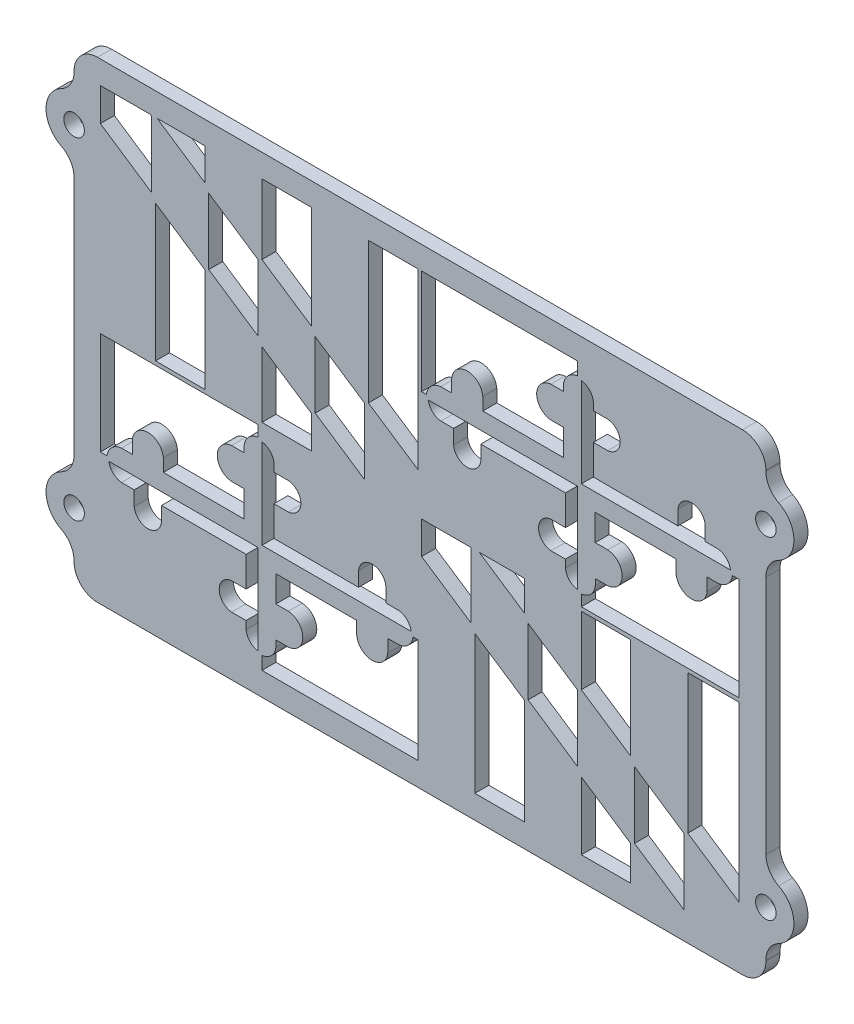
SolidWorks part; units mm, degrees
ref_plane "Front Plane" through (0, 0, 0) normal (0, 0, 1) x (1, 0, 0)
ref_plane "Top Plane" through (0, 0, 0) normal (0, 1, 0) x (1, 0, 0)
ref_plane "Right Plane" through (0, 0, 0) normal (1, 0, 0) x (0, 0, -1)
sketch "Sketch1" plane through (0, 0, 0) normal (0, 0, 1) x (1, 0, 0)
  line L1 (-74, -35.5) -> (74, -35.5) construction
  line L2 (-74, -35.5) -> (-74, 35.5) construction
  line L3 (-74, 35.5) -> (74, 35.5) construction
  line L4 (74, -35.5) -> (74, 35.5) construction
  line L5 (-74, -35.5) -> (74, 35.5) construction
  line L6 (-74, 35.5) -> (74, -35.5) construction
  circle A0 centre (-74, 35.5) radius 2.2
  circle A1 centre (-74, 35.5) radius 6
  circle A2 centre (74, 35.5) radius 2.2
  circle A3 centre (74, 35.5) radius 6
  circle A4 centre (74, -35.5) radius 2.2
  circle A5 centre (74, -35.5) radius 6
  circle A6 centre (-74, -35.5) radius 2.2
  circle A7 centre (-74, -35.5) radius 6
  point P0 (0, 0)
  dimension "D3" = 4.4
  dimension "D4" = 12
  dimension "D5" = 4.4
  dimension "D6" = 12
  dimension "D7" = 4.4
  dimension "D8" = 12
  dimension "D9" = 4.4
  dimension "D10" = 12
  dimension "D1" = 148
  dimension "D2" = 71
extrude "Boss-Extrude1" add sketch "Sketch1" along normal blind 3
sketch "Sketch2" plane through (0, 0, 0) normal (0, 0, 1) x (1, 0, 0)
  line L1 (-74, -50.5) -> (74, -50.5)
  line L2 (-74, -50.5) -> (-74, 50.5)
  line L3 (-74, 50.5) -> (74, 50.5)
  line L4 (74, -50.5) -> (74, 50.5)
  circle A2 centre (74, -35.5) radius 6 construction
  circle A3 centre (74, 35.5) radius 6 construction
  point P0 (0, 0)
  dimension "D2" = 15
  dimension "D3" = 15
  dimension "D1" = 148
  dimension "D4" = 74
extrude "Boss-Extrude3" add sketch "Sketch2" along normal blind 3 contours L3 L4 L1 L2
sketch "Sketch3" plane through (0, 0, 0) normal (0, 0, 1) x (1, 0, 0)
  line L0 (-74, 33.3) -> (-74, 37.7) construction
  line L1 (74, 33.3) -> (74, 37.7) construction
  line L2 (74, -37.7) -> (74, -33.3) construction
  line L3 (-74, -37.7) -> (-74, -33.3) construction
  circle A0 centre (-74, 35.5) radius 2.2
  circle A1 centre (74, 35.5) radius 2.2
  circle A2 centre (74, -35.5) radius 2.2
  circle A3 centre (-74, -35.5) radius 2.2
  dimension "D1" = 4.4
  dimension "D2" = 4.4
  dimension "D3" = 4.4
  dimension "D4" = 4.4
extrude "Cut-Extrude2" cut sketch "Sketch3" along normal blind 3
fillet "Fillet2" radius 5
fillet "Fillet3" radius 5
sketch "Sketch4" plane through (0, 0, 3) normal (0, 0, 1) x (1, 0, 0)
  line L0 (-24.1234, -47.7608) -> (29.7121, -47.7608) construction
  line L2 (-69, -50.5) -> (69, -50.5) construction
  line L3 (-68, -45.5) -> (68, -45.5)
  line L4 (-68, -45.5) -> (-68, 45.5)
  line L5 (-68, 45.5) -> (68, 45.5)
  line L6 (68, -45.5) -> (68, 45.5)
  line L7 (-68, -45.5) -> (68, 45.5) construction
  line L8 (-68, 45.5) -> (68, -45.5) construction
  line L10 (74, -25.702) -> (74, 25.702) construction
  point P4 (0, 0)
  dimension "D1" = 5
  dimension "D2" = 6
sketch "Sketch5" plane through (0, 0, 3) normal (0, 0, 1) x (1, 0, 0)
  line L0 (-68.3847, 45.5773) -> (-68.3847, 38.5233)
  line L1 (-56.2579, 45.5773) -> (-46.0193, 38.7533)
  line L2 (-57.7362, 45.5773) -> (-57.407, 45.3579)
  line L3 (-11.8563, 0.8277) -> (-22.4241, 7.8747)
  line L4 (12.6832, -0.3719) -> (22.3067, -6.786)
  line L5 (11.7389, -45.5013) -> (11.7389, -15.8922)
  line L6 (22.3067, -45.5013) -> (22.3067, -22.9392)
  line L7 (34.5142, -45.5013) -> (34.5142, -31.0798)
  line L8 (45.082, -45.5013) -> (45.082, -38.1268)
  line L9 (56.4697, -44.7351) -> (56.4697, -30.5409)
  line L10 (-11.0364, 45.5773) -> (-11.0364, 15.4372)
  line L11 (-23.244, 45.5773) -> (-23.244, 23.5736)
  line L12 (-33.8118, 45.5773) -> (-33.8118, 30.617)
  line L13 (-46.0193, 45.5773) -> (-46.0193, 38.7533)
  line L14 (-57.407, 45.3579) -> (-57.407, 31.2029)
  line L15 (37.5054, 5.8845) -> (37.5054, 7.1719)
  line L16 (37.5054, 7.1719) -> (40.1998, 7.1719)
  line L17 (40.1814, 13.8239) -> (37.4881, 13.8239)
  line L18 (37.4881, 13.8239) -> (37.4881, 19.4384)
  line L19 (37.4881, 19.4384) -> (54.7798, 19.4384)
  line L20 (54.7798, 19.4384) -> (54.7798, 16.7451)
  line L21 (61.4318, 16.7267) -> (61.4318, 19.4211)
  line L22 (61.4318, 19.4211) -> (63.767, 19.4211)
  line L23 (30.7032, 39.7308) -> (30.7032, 38.4435)
  line L24 (30.7032, 38.4435) -> (28.0088, 38.4435)
  line L25 (28.0272, 31.7914) -> (30.7204, 31.7914)
  line L26 (30.7204, 31.7914) -> (30.7204, 26.1769)
  line L27 (30.7204, 26.1769) -> (13.4287, 26.1769)
  line L28 (13.4287, 26.1769) -> (13.4287, 28.8702)
  line L29 (6.7767, 28.8886) -> (6.7767, 26.1942)
  line L30 (6.7767, 26.1942) -> (4.4416, 26.1942)
  line L31 (-37.6228, -5.8085) -> (-37.6228, -7.0958)
  line L32 (-37.6228, -7.0958) -> (-40.3172, -7.0958)
  line L33 (-40.2988, -13.7478) -> (-37.6056, -13.7478)
  line L34 (-37.6056, -13.7478) -> (-37.6056, -19.3623)
  line L35 (-37.6056, -19.3623) -> (-54.8973, -19.3623)
  line L36 (-54.8973, -19.3623) -> (-54.8973, -16.6691)
  line L37 (-61.5493, -16.6507) -> (-61.5493, -19.3451)
  line L38 (-61.5493, -19.3451) -> (-63.8844, -19.3451)
  line L39 (-30.8206, -39.6548) -> (-30.8206, -38.3674)
  line L40 (-30.8206, -38.3674) -> (-28.1262, -38.3674)
  line L41 (-28.1446, -31.7154) -> (-30.8379, -31.7154)
  line L42 (-30.8379, -31.7154) -> (-30.8379, -26.1009)
  line L43 (-30.8379, -26.1009) -> (-13.5462, -26.1009)
  line L44 (-13.5462, -26.1009) -> (-13.5462, -28.7942)
  line L45 (-6.8942, -28.8126) -> (-6.8942, -26.1182)
  line L46 (-6.8942, -26.1182) -> (-4.559, -26.1182)
  line L47 (-0.4687, 45.5773) -> (-0.4687, 8.3938)
  line L48 (-68.3847, -0.3719) -> (-34.6317, -0.3719)
  line L49 (0.3512, -0.3719) -> (0.3512, -7.3129)
  line L50 (0.3512, -0.3719) -> (10.919, -0.3719)
  line L51 (-34.6317, -0.3719) -> (-34.6317, -2.7353)
  line L52 (-0.4687, -23.1416) -> (-1.4875, -23.1416)
  line L53 (33.6943, 45.5773) -> (33.6943, 42.804)
  line L54 (68.2673, 22.3977) -> (66.8385, 22.3977)
  line L55 (33.6943, 22.3977) -> (1.7834, 22.3977)
  line L56 (33.6943, 22.3977) -> (33.6943, 3.2244)
  line L57 (63.7482, 25.7842) -> (61.0219, 25.7842)
  line L58 (61.0219, 25.7842) -> (61.0219, 28.8702)
  line L59 (55.1898, 28.853) -> (55.1898, 25.767)
  line L60 (55.1898, 25.767) -> (37.0782, 25.767)
  line L61 (37.0782, 25.767) -> (37.0782, 32.2014)
  line L62 (37.0782, 32.2014) -> (40.1642, 32.2014)
  line L63 (40.1814, 38.0335) -> (37.0954, 38.0335)
  line L64 (37.0954, 38.0335) -> (37.0954, 39.712)
  line L65 (34.5142, 0.448) -> (68.2673, 0.448)
  line L66 (4.4604, 19.8311) -> (7.1867, 19.8311)
  line L67 (7.1867, 19.8311) -> (7.1867, 16.7451)
  line L68 (13.0188, 16.7623) -> (13.0188, 19.8483)
  line L69 (13.0188, 19.8483) -> (31.1304, 19.8483)
  line L70 (31.1304, 19.8483) -> (31.1304, 13.4139)
  line L71 (31.1304, 13.4139) -> (28.0444, 13.4139)
  line L72 (28.0271, 7.5818) -> (31.1131, 7.5818)
  line L73 (31.1131, 7.5818) -> (31.1131, 5.9033)
  line L74 (1.3701, 23.2176) -> (0.3512, 23.2176)
  line L75 (34.5142, 2.8113) -> (34.5142, 0.448)
  line L76 (34.5142, 42.3909) -> (34.5142, 23.2176)
  line L77 (66.4251, 23.2176) -> (34.5142, 23.2176)
  line L78 (-33.8118, 0.448) -> (-23.244, 0.448)
  line L79 (-33.8118, -3.1484) -> (-33.8118, -22.3217)
  line L80 (-34.6317, -23.1416) -> (-34.6317, -42.3149)
  line L81 (-34.6317, -23.1416) -> (-66.5426, -23.1416)
  line L82 (-4.5778, -19.7551) -> (-7.3041, -19.7551)
  line L83 (-7.3041, -19.7551) -> (-7.3041, -16.669)
  line L84 (-13.1362, -16.6863) -> (-13.1362, -19.7723)
  line L85 (-13.1362, -19.7723) -> (-31.2478, -19.7723)
  line L86 (-31.2478, -19.7723) -> (-31.2478, -13.3379)
  line L87 (-31.2478, -13.3379) -> (-28.1618, -13.3379)
  line L88 (-28.1446, -7.5058) -> (-31.2306, -7.5058)
  line L89 (-31.2306, -7.5058) -> (-31.2306, -5.8273)
  line L90 (-1.9009, -22.3217) -> (-33.8118, -22.3217)
  line L91 (-33.8118, -42.728) -> (-33.8118, -45.5013)
  line L92 (-33.8118, -45.5013) -> (-0.4687, -45.5013)
  line L93 (-63.8656, -25.7082) -> (-61.1393, -25.7082)
  line L94 (-61.1393, -25.7082) -> (-61.1393, -28.7942)
  line L95 (-55.3072, -28.777) -> (-55.3072, -25.691)
  line L96 (-55.3072, -25.691) -> (-37.1956, -25.691)
  line L97 (-37.1956, -25.691) -> (-37.1956, -32.1254)
  line L98 (-37.1956, -32.1254) -> (-40.2816, -32.1254)
  line L99 (-40.2989, -37.9575) -> (-37.2129, -37.9575)
  line L100 (-37.2129, -37.9575) -> (-37.2129, -39.6359)
  line L101 (-66.9559, -22.3217) -> (-68.3847, -22.3217)
  line L102 (-56.5871, 0.448) -> (-46.0193, 0.448)
  line L103 (-57.407, 31.2029) -> (-68.3847, 38.5233)
  line L104 (-56.5871, 29.6706) -> (-56.5871, 0.448)
  line L105 (-46.0193, 22.6236) -> (-56.5871, 29.6706)
  line L106 (-46.0193, 22.6236) -> (-46.0193, 0.448)
  line L107 (-34.6317, 16.0153) -> (-45.1994, 23.0623)
  line L108 (-33.8118, 14.483) -> (-33.8118, 0.448)
  line L109 (-23.244, 7.436) -> (-33.8118, 14.483)
  line L110 (-23.244, 7.436) -> (-23.244, 0.448)
  line L111 (10.919, -14.3599) -> (0.3512, -7.3129)
  line L112 (10.919, -14.3599) -> (10.919, -0.3719)
  line L113 (23.1266, -22.5005) -> (23.1266, -8.3178)
  line L114 (22.3067, -22.9392) -> (11.7389, -15.8922)
  line L115 (33.6943, -29.5475) -> (23.1266, -22.5005)
  line L116 (33.6943, -29.5475) -> (33.6943, -15.3612)
  line L117 (45.082, -38.1268) -> (34.5142, -31.0798)
  line L118 (45.9019, -37.6881) -> (45.9019, -23.4975)
  line L119 (56.4697, -44.7351) -> (45.9019, -37.6881)
  line L120 (68.2673, -37.4187) -> (68.2673, -0.3719)
  line L121 (57.2896, -30.1021) -> (68.2673, -37.4187)
  line L122 (57.2896, -30.1021) -> (57.2896, -0.3719)
  line L123 (45.9019, -23.4975) -> (56.4697, -30.5409)
  line L124 (45.082, -21.9657) -> (45.082, -0.3719)
  line L125 (34.5142, -14.9223) -> (45.082, -21.9657)
  line L126 (34.5142, -14.9223) -> (34.5142, -0.3719)
  line L127 (23.1266, -8.3178) -> (33.6943, -15.3612)
  line L128 (22.3067, -6.786) -> (22.3067, -0.3719)
  line L129 (12.6832, -0.3719) -> (22.3067, -0.3719)
  line L130 (-11.0364, 15.4372) -> (-0.4687, 8.3938)
  line L131 (-11.8563, 14.9983) -> (-11.8563, 0.8277)
  line L132 (-22.4241, 22.0418) -> (-11.8563, 14.9983)
  line L133 (-22.4241, 22.0418) -> (-22.4241, 7.8747)
  line L134 (-33.8118, 30.617) -> (-23.244, 23.5736)
  line L135 (-34.6317, 30.1781) -> (-34.6317, 16.0153)
  line L136 (-45.1994, 37.2215) -> (-34.6317, 30.1781)
  line L137 (-45.1994, 37.2215) -> (-45.1994, 23.0623)
  line L138 (-57.7362, 45.5773) -> (-68.3847, 45.5773)
  line L139 (-46.0193, 45.5773) -> (-56.2579, 45.5773)
  line L140 (-23.244, 45.5773) -> (-33.8118, 45.5773)
  line L141 (-0.4687, 45.5773) -> (-11.0364, 45.5773)
  line L142 (33.6943, 45.5773) -> (0.3512, 45.5773)
  line L143 (68.2673, 0.448) -> (68.2673, 22.3977)
  line L144 (57.2896, -0.3719) -> (68.2673, -0.3719)
  line L145 (34.5142, -0.3719) -> (45.082, -0.3719)
  line L146 (34.5142, -45.5013) -> (45.082, -45.5013)
  line L147 (11.7389, -45.5013) -> (22.3067, -45.5013)
  line L148 (-68.3847, -0.3719) -> (-68.3847, -22.3217)
  line L149 (-0.4687, -23.1416) -> (-0.4687, -45.5013)
  line L150 (0.3512, 23.2176) -> (0.3512, 45.5773)
  arc A0 (34.5142, 2.8113) -> (37.5054, 5.8845) centre (34.1212, 6.186) ccw
  arc A1 (40.1998, 7.1719) -> (40.1814, 13.8239) centre (39.9107, 10.4971) ccw
  arc A2 (54.7798, 16.7451) -> (61.4318, 16.7267) centre (58.1066, 17.0158) ccw
  arc A3 (63.767, 19.4211) -> (66.8385, 22.3977) centre (63.4655, 22.8053) ccw
  arc A4 (33.6943, 42.804) -> (30.7032, 39.7308) centre (34.0873, 39.4293) ccw
  arc A5 (28.0088, 38.4435) -> (28.0272, 31.7914) centre (28.2978, 35.1182) ccw
  arc A6 (13.4287, 28.8702) -> (6.7767, 28.8886) centre (10.1019, 28.5995) ccw
  arc A7 (4.4416, 26.1942) -> (1.3701, 23.2176) centre (4.7431, 22.81) ccw
  arc A8 (-34.6317, -2.7353) -> (-37.6228, -5.8085) centre (-34.2387, -6.11) ccw
  arc A9 (-40.3172, -7.0958) -> (-40.2988, -13.7478) centre (-40.0282, -10.4211) ccw
  arc A10 (-54.8973, -16.6691) -> (-61.5493, -16.6507) centre (-58.2241, -16.9397) ccw
  arc A11 (-63.8844, -19.3451) -> (-66.9559, -22.3217) centre (-63.5829, -22.7292) ccw
  arc A12 (-33.8118, -42.728) -> (-30.8206, -39.6548) centre (-34.2048, -39.3532) ccw
  arc A13 (-28.1262, -38.3674) -> (-28.1446, -31.7154) centre (-28.4153, -35.0422) ccw
  arc A14 (-13.5462, -28.7942) -> (-6.8942, -28.8126) centre (-10.2194, -28.5235) ccw
  arc A15 (-4.559, -26.1182) -> (-1.4875, -23.1416) centre (-4.8605, -22.734) ccw
  arc A16 (66.4251, 23.2176) -> (63.7482, 25.7842) centre (63.4655, 22.81) ccw
  arc A17 (61.0219, 28.8702) -> (55.1898, 28.853) centre (58.1066, 28.5995) ccw
  arc A18 (40.1642, 32.2014) -> (40.1814, 38.0335) centre (39.9107, 35.1182) ccw
  arc A19 (37.0954, 39.712) -> (34.5142, 42.3909) centre (34.1212, 39.4293) ccw
  arc A20 (1.7834, 22.3977) -> (4.4604, 19.8311) centre (4.7431, 22.8053) ccw
  arc A21 (7.1867, 16.7451) -> (13.0188, 16.7623) centre (10.1019, 17.0158) ccw
  arc A22 (28.0444, 13.4139) -> (28.0271, 7.5818) centre (28.2978, 10.4971) ccw
  arc A23 (31.1131, 5.9033) -> (33.6943, 3.2244) centre (34.0873, 6.186) ccw
  arc A24 (-1.9009, -22.3217) -> (-4.5778, -19.7551) centre (-4.8605, -22.7292) ccw
  arc A25 (-7.3041, -16.669) -> (-13.1362, -16.6863) centre (-10.2194, -16.9397) ccw
  arc A26 (-28.1618, -13.3379) -> (-28.1446, -7.5058) centre (-28.4153, -10.4211) ccw
  arc A27 (-31.2306, -5.8273) -> (-33.8118, -3.1484) centre (-34.2048, -6.11) ccw
  arc A28 (-66.5426, -23.1416) -> (-63.8656, -25.7082) centre (-63.5829, -22.734) ccw
  arc A29 (-61.1393, -28.7942) -> (-55.3072, -28.777) centre (-58.2241, -28.5235) ccw
  arc A30 (-40.2816, -32.1254) -> (-40.2989, -37.9575) centre (-40.0282, -35.0422) ccw
  arc A31 (-37.2129, -39.6359) -> (-34.6317, -42.3149) centre (-34.2387, -39.3532) ccw
extrude "Cut-Extrude3" cut sketch "Sketch5" against normal through all
